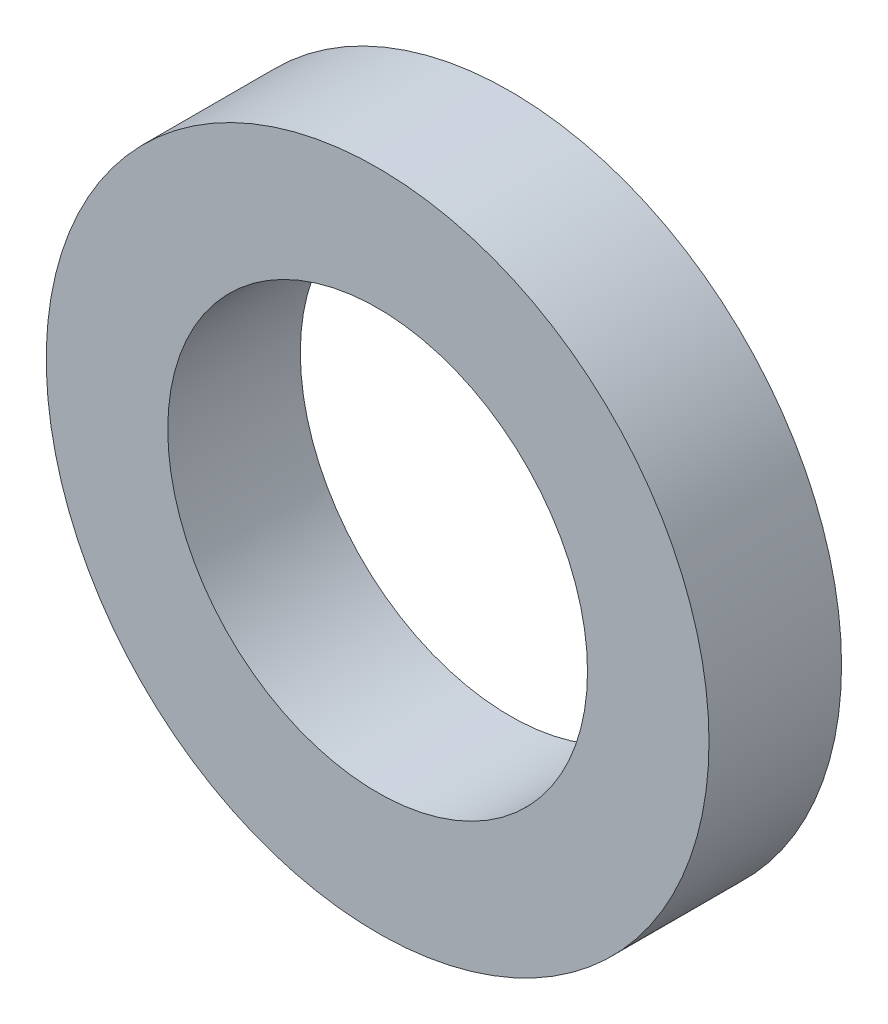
SolidWorks part; units mm, degrees
ref_plane "Face" through (0, 0, 0) normal (0, 0, 1) x (1, 0, 0)
ref_plane "Dessus" through (0, 0, 0) normal (0, 1, 0) x (1, 0, 0)
ref_plane "Droite" through (0, 0, 0) normal (1, 0, 0) x (0, 0, -1)
imported_body "Importée1"
sketch "Esquisse1" plane through (0, 0, -27) normal (0, 0, -1) x (-1, 0, 0)
  circle A0 centre (-17.14, 214.32) radius 4.75
  circle A1 centre (-17.14, 214.32) radius 4.05 construction
  dimension "D1" = 9.5
extrude "Enlèv. mat.-Extru.1" cut sketch "Esquisse1" against normal through all
